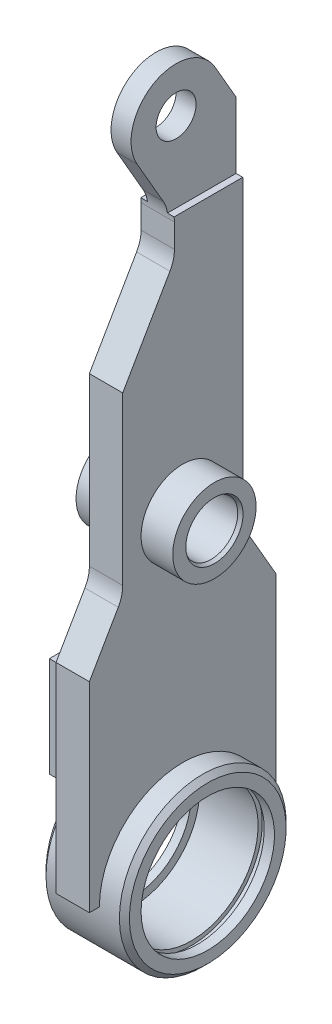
SolidWorks part; units mm, degrees
ref_plane "Face" through (0, 0, 0) normal (0, 0, 1) x (1, 0, 0)
ref_plane "Dessus" through (0, 0, 0) normal (0, 1, 0) x (1, 0, 0)
ref_plane "Droite" through (0, 0, 0) normal (1, 0, 0) x (0, 0, -1)
sketch "Esquisse1" plane through (0, 0, 0) normal (0, 0, 1) x (1, 0, 0)
  line L0 (0, 0) -> (67.8543, 0) construction
  line L2 (-12.5, 25) -> (12.5, 25)
  line L5 (0, 25) -> (0, 54.2232) construction
  line L12 (9.45, 20) -> (12.5, 20)
  line L13 (7.6, 21.25) -> (7.6, 20)
  line L14 (9.45, 21.25) -> (7.6, 21.25)
  line L15 (9.45, 20) -> (9.45, 21.25)
  line L16 (-10, 17.5) -> (-12.5, 17.5)
  line L17 (-10, 20) -> (-10, 17.5)
  line L18 (-10, 20) -> (7.6, 20)
  line L19 (-12.5, 25) -> (-12.5, 17.5)
  line L20 (12.5, 20) -> (12.5, 25)
  point P6 (0, 0)
  dimension "D1" = 35
  dimension "D2" = 40
  dimension "D3" = 25
  dimension "D4" = 42.5
  dimension "D5" = 25
  dimension "D6" = 3.05
  dimension "D7" = 1.85
  dimension "D8" = 22.5
revolve "Révolution1" add sketch "Esquisse1" angle 360 about L0
sketch "Esquisse2" plane through (0, 0, 0) normal (1, 0, 0) x (0, 0, -1)
  line L0 (28, 210) -> (28, 0)
  line L1 (-28, 210) -> (-28, 0)
  line L2 (25, 0) -> (28, 0)
  line L3 (-25, 0) -> (-28, 0)
  line L4 (28, 210) -> (-28, 210)
  arc A1 (25, 0) -> (-25, 0) centre (0, 0) ccw
  circle A2 centre (0, 0) radius 25 construction
  circle A3 centre (0, 0) radius 17.5 construction
  dimension "D1" = 210
  dimension "D2" = 56
  dimension "D3" = 28
extrude "Extrusion1" add sketch "Esquisse2" along normal mid plane 10 separate body
sketch "Esquisse3" plane through (-5, 0, 0) normal (1, 0, 0) x (0, 0, -1)
  line L1 (-24.9986, 57) -> (25, 57)
  line L2 (-24.9986, 57) -> (-24.9986, 27)
  line L3 (-24.9986, 27) -> (25, 27)
  line L4 (25, 57) -> (25, 27)
  dimension "D1" = 30
  dimension "D2" = 27
  dimension "D3" = 25
  dimension "D4" = 49.9986
extrude "Extrusion2" add sketch "Esquisse3" against normal blind 5 separate body
sketch "Esquisse4" plane through (5, 0, 0) normal (1, 0, 0) x (0, 0, -1)
  line L0 (25, 57) -> (-24.9986, 57) construction
  line L1 (-28, 210) -> (-18, 210)
  line L2 (-28, 210) -> (-28, 60)
  line L3 (-28, 60) -> (-19.3397, 75)
  line L4 (-18, 210) -> (-18, 80)
  line L5 (28, 210) -> (18, 210)
  line L6 (28, 210) -> (28, 60)
  line L7 (28, 60) -> (19.3397, 75)
  line L8 (18, 210) -> (18, 80)
  line L9 (28, 0) -> (28, 210) construction
  line L10 (-28, 210) -> (-28, 0) construction
  arc A0 (-19.3397, 75) -> (-18, 80) centre (-28, 80) ccw
  arc A1 (18, 80) -> (19.3397, 75) centre (28, 80) ccw
  dimension "D4" = 10
  dimension "D1" = 60
  dimension "D2" = 10
  dimension "D3" = 10
  dimension "D5" = 60
  dimension "D6" = 60
  dimension "D7" = 60
extrude "Enlèv. mat.-Extru.1" cut sketch "Esquisse4" against normal blind 10
chamfer "Chanfrein1" distance 1.5 angle 45 2 edges at (-12.5, 0, 25) (12.5, 0, 25)
sketch "Esquisse6" plane through (0, 0, 0) normal (1, 0, 0) x (0, 0, -1)
  circle A0 centre (0, 90) radius 12.5
  dimension "D1" = 25
  dimension "D2" = 90
extrude "Enlèv. mat.-Extru.2" cut sketch "Esquisse6" against normal mid plane 10
sketch "Esquisse7" plane through (0, 0, 0) normal (1, 0, 0) x (0, 0, -1)
  circle A0 centre (0, 90) radius 12.5 construction
  circle A1 centre (0, 90) radius 12.5
  circle A2 centre (0, 90) radius 8
  dimension "D1" = 16
extrude "Extrusion3" add sketch "Esquisse7" along normal mid plane 29 separate body
sketch "Esquisse8" plane through (0, 210, 0) normal (0, 1, 0) x (-1, 0, 0)
  line L0 (5, 18) -> (-5, 18) construction
  line L1 (-5, -18) -> (-3, -18)
  line L2 (-5, -18) -> (-5, 18)
  line L3 (-5, 18) -> (-3, 18)
  line L4 (-3, -18) -> (-3, 18)
  line L6 (5, -18) -> (3, -18)
  line L7 (5, -18) -> (5, 18)
  line L8 (5, 18) -> (3, 18)
  line L9 (3, -18) -> (3, 18)
  dimension "D1" = 2
  dimension "D2" = 2
extrude "Enlèv. mat.-Extru.3" cut sketch "Esquisse8" against normal blind 42
fillet "Congé1" radius 18 2 edges at (0, 210, -18) (0, 210, 18)
sketch "Esquisse9" plane through (5, 0, 0) normal (1, 0, 0) x (0, 0, -1)
  circle A0 centre (0, 192) radius 6
  dimension "D1" = 12
  dimension "D2" = 192
extrude "Enlèv. mat.-Extru.4" cut sketch "Esquisse9" against normal blind 10
ref_point "Point1"
sketch "Esquisse10" plane through (0, 0, 0) normal (1, 0, 0) x (0, 0, -1)
  line L0 (11.6913, 198.75) -> (18, 187.8231)
  line L2 (-11.6913, 185.25) -> (-3.8397, 171.6506)
  line L3 (-3.8397, 154.5263) -> (-18, 130)
  line L6 (-18, 130) -> (-18, 192)
  line L7 (18, 187.8231) -> (18, 192)
  line L8 (-2.5, 166.6506) -> (-2.5, 159.5263)
  arc A0 (11.6913, 198.75) -> (-11.6913, 185.25) centre (0, 192) ccw
  arc A1 (-3.8397, 171.6506) -> (-2.5, 166.6506) centre (-12.5, 166.6506) cw
  arc A2 (-3.8397, 154.5263) -> (-2.5, 159.5263) centre (-12.5, 159.5263) ccw
  arc A4 (18, 192) -> (-18, 192) centre (0, 192) ccw
  dimension "D1" = 13.5
  dimension "D2" = 30
  dimension "D5" = 10
  dimension "D3" = 20.5
  dimension "D4" = 30
extrude "Enlèv. mat.-Extru.5" cut sketch "Esquisse10" against normal mid plane 10
hole_wizard "Trou taraudé M4x0.71" positions "Esquisse12" profile "Esquisse11" tap size "M4x0.7" standard "DIN"
sketch "Esquisse12" plane through (-10, 0, 0) normal (-1, 0, 0) x (0, 0, 1)
  point P0 (-18, 35)
  point P3 (18, 49)
  dimension "D1" = 35
  dimension "D2" = 18
  dimension "D3" = 18
  dimension "D4" = 49
sketch "Esquisse11" plane through (-10, 35, -18) normal (0, 1, 0) x (0, 0, 1)
  line L0 (0, 0) -> (0, 12.4526)
  line L1 (0, 12.4526) -> (1.65, 11.5)
  line L2 (1.65, 11.5) -> (1.65, 0)
  line L5 (1.65, 0) -> (0, 0)
  line L10 (0, 12.4526) -> (-1.65, 11.5) construction
  line L11 (0, -6.35) -> (0, 107.95) construction
  dimension "Diamètre du trou pour taraudage" = 3.3
  dimension "Profondeur du trou pour taraudage" = 11.5
  dimension "Angle de pointe" = 120
chamfer "Chanfrein2" distance 1 angle 30 2 edges at (14.5, 90, -8) (-14.5, 90, -8)
